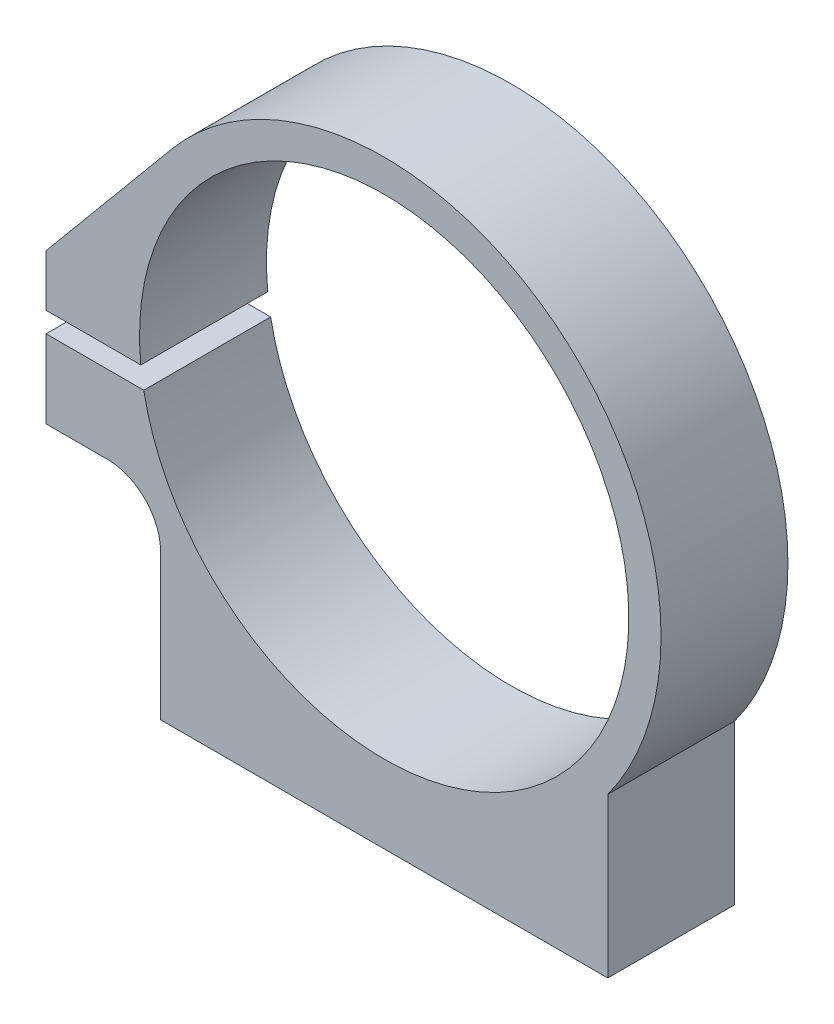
SolidWorks part; units mm, degrees
ref_plane "Front Plane" through (0, 0, 0) normal (0, 0, 1) x (1, 0, 0)
ref_plane "Top Plane" through (0, 0, 0) normal (0, 1, 0) x (1, 0, 0)
ref_plane "Right Plane" through (0, 0, 0) normal (1, 0, 0) x (0, 0, -1)
sketch "Sketch1" plane through (0, 0, 60.3309) normal (0, 0, 1) x (1, 0, 0)
  line L0 (16.7386, -12.223) -> (16.7386, -24.13)
  line L1 (16.7386, -24.13) -> (-16.7386, -24.13)
  line L2 (-16.7386, -24.13) -> (-16.7386, -13.2143)
  line L3 (-20.72, -9.2329) -> (-25.3111, -9.2329)
  line L4 (-25.3111, -9.2329) -> (-25.3111, -3.3909)
  line L5 (-25.3111, -3.3909) -> (-17.9967, -3.3909)
  line L6 (-18.218, -1.8669) -> (-25.3111, -1.8669)
  line L7 (-25.3111, -1.8669) -> (-25.3111, 1.9939)
  line L8 (-25.3111, 1.9939) -> (-15.9274, 13.2628)
  line L9 (0, -24.13) -> (0, 0) construction
  line L10 (0, 20.7264) -> (10.0318, 20.7264) construction
  line L11 (20.7264, 0) -> (20.7264, 10.4833) construction
  circle A0 centre (0, 0) radius 18.3134 construction
  arc A1 (-17.9967, -3.3909) -> (-18.218, -1.8669) centre (0, 0) ccw
  arc A2 (-15.9274, 13.2628) -> (16.7386, -12.223) centre (0, 0) cw
  arc A3 (-16.7386, -13.2143) -> (-20.72, -9.2329) centre (-20.72, -13.2143) ccw
  point P21 (-25.3111, -1.8669)
  point P22 (-25.3111, 3.0535)
  point P23 (-20.72, -9.2329)
  dimension "D1" = 20.7264
  dimension "D2" = 33.4772
  dimension "D3" = 44.8564
  dimension "D4" = 46.0375
  dimension "D5" = 20.7391
  dimension "D6" = 1.524
  dimension "D7" = 11.2268
  dimension "D8" = 5.842
extrude "Boss-Extrude1" add sketch "Sketch1" against normal blind 9.4996
sketch "Sketch2" plane through (0, -24.13, 0) normal (0, -1, 0) x (1, 0, 0)
  line L0 (15.0368, 55.5811) -> (16.7386, 55.5811) construction
  line L1 (16.7386, 50.8313) -> (16.7386, 60.3309) construction
  line L2 (12.0777, 55.5811) -> (-12.0777, 55.5811) construction
  line L3 (-15.0368, 55.5811) -> (-16.7386, 55.5811) construction
  line L4 (-16.7386, 50.8313) -> (-16.7386, 60.3309) construction
  circle A0 centre (-13.5572, 55.5811) radius 1.4795
  circle A1 centre (13.5572, 55.5811) radius 1.4795
  point P14 (0, 0)
  point P15 (0, 0)
  dimension "D2" = 2.9591
  dimension "D1" = 24.1554
extrude "Cut-Extrude1" cut sketch "Sketch2" against normal blind 6.35
